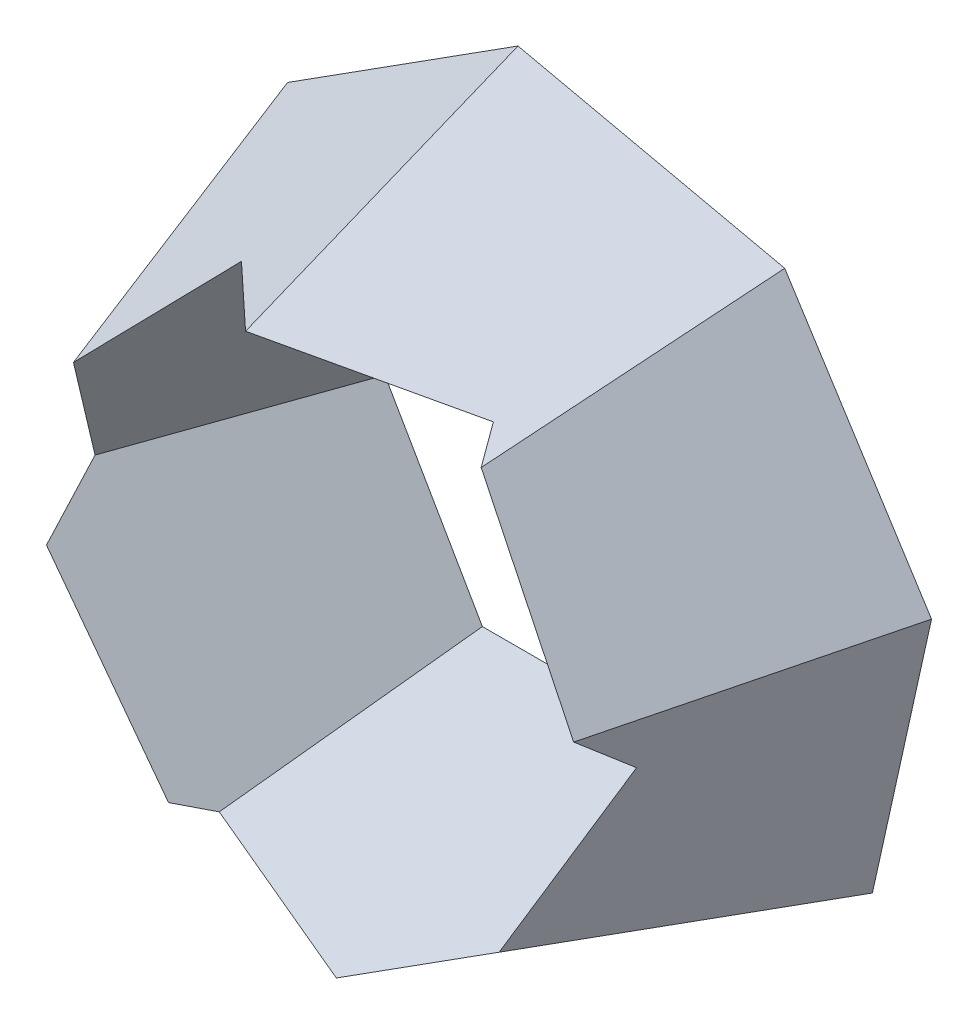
SolidWorks part; units mm, degrees
ref_plane "Front" through (0, 0, 0) normal (0, 0, 1) x (1, 0, 0)
ref_plane "Top" through (0, 0, 0) normal (0, 1, 0) x (1, 0, 0)
ref_plane "Right" through (0, 0, 0) normal (1, 0, 0) x (0, 0, -1)
sketch "Sketch1" plane through (0, 0, 0) normal (0, 0, 1) x (1, 0, 0)
  line L0 (0, 0) -> (106.6325, 0) construction
  line L1 (25, 0) -> (12.5, 21.6506)
  line L2 (12.5, 21.6506) -> (-12.5, 21.6506)
  line L3 (-12.5, 21.6506) -> (-25, 0)
  line L4 (-25, 0) -> (-12.5, -21.6506)
  line L5 (-12.5, -21.6506) -> (12.5, -21.6506)
  line L6 (12.5, -21.6506) -> (25, 0)
  line L7 (-37.4596, 26.2295) -> (-45.035, -7.9409)
  line L8 (-45.035, -7.9409) -> (-26.2295, -37.4596)
  line L9 (-26.2295, -37.4596) -> (7.9409, -45.035)
  line L10 (7.9409, -45.035) -> (37.4596, -26.2295)
  line L11 (37.4596, -26.2295) -> (45.035, 7.9409)
  line L12 (45.035, 7.9409) -> (26.2295, 37.4596)
  line L13 (26.2295, 37.4596) -> (-7.9409, 45.035)
  line L14 (-7.9409, 45.035) -> (-37.4596, 26.2295)
  line L15 (0, 0) -> (-37.4596, 26.2295) construction
  circle A0 centre (0, 0) radius 21.6506 construction
  circle A1 centre (0, 0) radius 45.7297 construction
  dimension "D1" = 25
  dimension "D2" = 145
  dimension "D3" = 35
extrude "Extrude1" add sketch "Sketch1" along normal blind 40 draft 17
